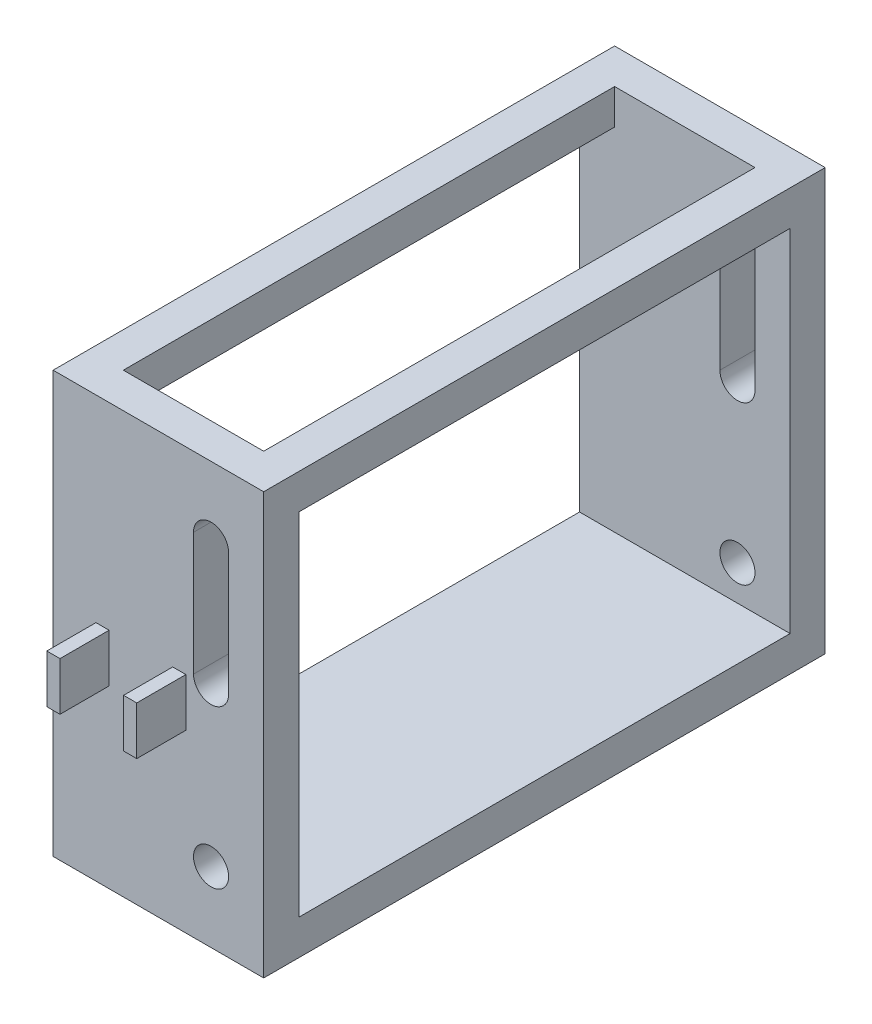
SolidWorks part; units mm, degrees
ref_plane "Front Plane" through (0, 0, 0) normal (0, 0, 1) x (1, 0, 0)
ref_plane "Top Plane" through (0, 0, 0) normal (0, 1, 0) x (1, 0, 0)
ref_plane "Right Plane" through (0, 0, 0) normal (1, 0, 0) x (0, 0, -1)
sketch "Sketch1" plane through (0, 0, 0) normal (0, 1, 0) x (1, 0, 0)
  line L1 (0, 0) -> (76.2, 0)
  line L2 (0, 0) -> (0, 203.2)
  line L3 (0, 203.2) -> (76.2, 203.2)
  line L4 (76.2, 0) -> (76.2, 203.2)
  dimension "D1" = 203.2
  dimension "D2" = 76.2
extrude "Boss-Extrude1" add sketch "Sketch1" along normal blind 12.7
sketch "Sketch2" plane through (0, 12.7, 0) normal (0, 1, 0) x (1, 0, 0)
  line L0 (76.2, 0) -> (76.2, 203.2) construction
  line L1 (0, 203.2) -> (76.2, 203.2)
  line L2 (0, 203.2) -> (0, 190.5)
  line L3 (0, 190.5) -> (76.2, 190.5)
  line L4 (76.2, 203.2) -> (76.2, 190.5)
  line L6 (0, 0) -> (76.2, 0)
  line L7 (0, 0) -> (0, 12.7)
  line L8 (0, 12.7) -> (76.2, 12.7)
  line L9 (76.2, 0) -> (76.2, 12.7)
  dimension "D1" = 12.7
  dimension "D2" = 12.7
extrude "Boss-Extrude2" add sketch "Sketch2" along normal blind 127
sketch "Sketch3" plane through (0, 139.7, 0) normal (0, 1, 0) x (1, 0, 0)
  line L0 (0, 203.2) -> (0, 0)
  line L1 (0, 0) -> (76.2, 0)
  line L2 (76.2, 0) -> (76.2, 203.2)
  line L3 (76.2, 203.2) -> (0, 203.2)
  line L4 (0, 190.5) -> (76.2, 190.5) construction
  line L5 (12.7, 190.5) -> (63.5, 190.5)
  line L6 (12.7, 190.5) -> (12.7, 12.7)
  line L7 (12.7, 12.7) -> (63.5, 12.7)
  line L8 (63.5, 190.5) -> (63.5, 12.7)
  line L9 (76.2, 12.7) -> (0, 12.7) construction
  dimension "D1" = 12.7
  dimension "D2" = 12.7
extrude "Boss-Extrude3" add sketch "Sketch3" along normal blind 12.7
sketch "Sketch4" plane through (0, 0, 0) normal (0, 0, 1) x (1, 0, 0)
  line L0 (0, 0) -> (76.2, 0) construction
  line L1 (76.2, 152.4) -> (76.2, 0) construction
  line L2 (50.8, 127) -> (50.8, 82.55)
  line L3 (63.5, 127) -> (63.5, 82.55)
  arc A0 (63.5, 127) -> (50.8, 127) centre (57.15, 127) ccw
  arc A1 (50.8, 82.55) -> (63.5, 82.55) centre (57.15, 82.55) ccw
  circle A2 centre (57.15, 25.4) radius 6.35
  point P12 (76.2, 76.2)
  dimension "D5" = 12.7
  dimension "D1" = 25.4
  dimension "D2" = 25.4
  dimension "D3" = 6.35
  dimension "D4" = 19.05
extrude "Cut-Extrude1" cut sketch "Sketch4" against normal through all
sketch "Sketch6" plane through (0, 0, 0) normal (0, 0, 1) x (1, 0, 0)
  line L0 (38.1, 152.4) -> (38.1, 0) construction
  line L1 (0, 152.4) -> (76.2, 152.4) construction
  line L2 (0, 0) -> (76.2, 0) construction
  line L3 (0, 152.4) -> (0, 0) construction
  line L12 (76.2, 76.2) -> (0, 76.2) construction
  line L13 (76.2, 152.4) -> (76.2, 0) construction
  line L15 (15.494, 81.026) -> (20.2565, 81.026)
  line L16 (15.494, 81.026) -> (15.494, 63.5635)
  line L17 (15.494, 63.5635) -> (20.2565, 63.5635)
  line L18 (20.2565, 81.026) -> (20.2565, 63.5635)
  line L19 (43.2753, 81.026) -> (48.0378, 81.026)
  line L20 (43.2753, 81.026) -> (43.2753, 63.5635)
  line L21 (43.2753, 63.5635) -> (48.0378, 63.5635)
  line L22 (48.0378, 81.026) -> (48.0378, 63.5635)
  dimension "D1" = 81.026
  dimension "D2" = 15.494
  dimension "D3" = 23.0188
  dimension "D4" = 4.7625
  dimension "D5" = 17.4625
extrude "Boss-Extrude4" add sketch "Sketch6" along normal blind 17.78
ref_plane "Plane1" through (0, 0, -101.6) normal (0, 0, 1) x (1, 0, 0)
mirror "Mirror1" about plane through (0, 0, -101.6) normal (0, 0, 1) of "Boss-Extrude4"
